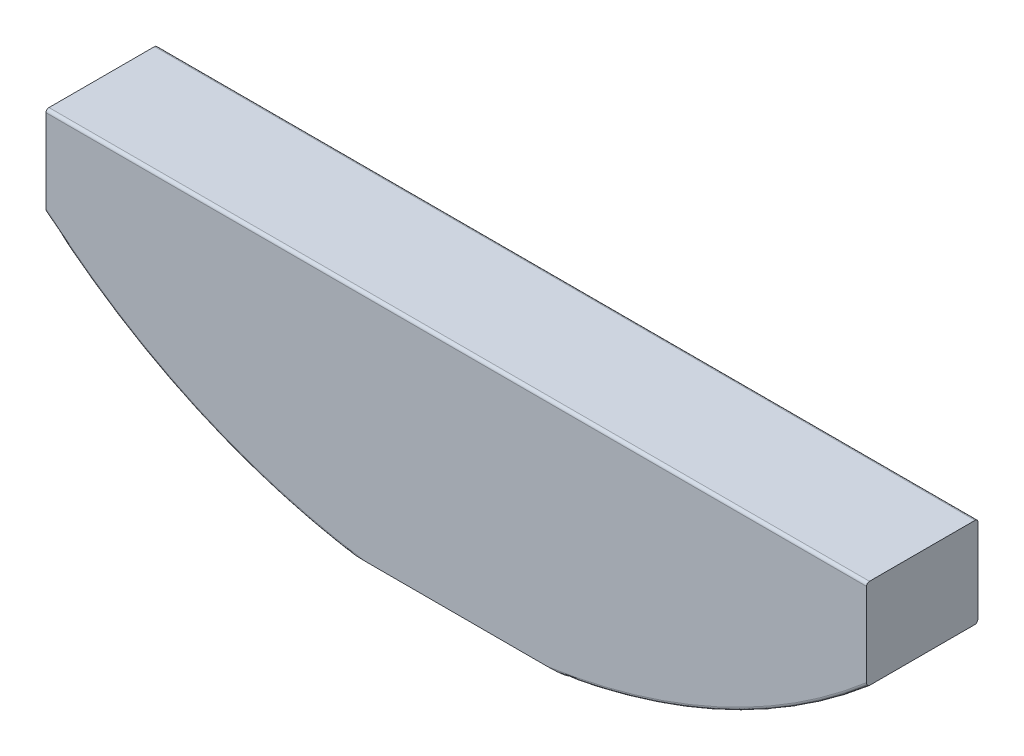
SolidWorks part; units mm, degrees
ref_plane "Front Plane" through (0, 0, 0) normal (0, 0, 1) x (1, 0, 0)
ref_plane "Top Plane" through (0, 0, 0) normal (0, 1, 0) x (1, 0, 0)
ref_plane "Right Plane" through (0, 0, 0) normal (1, 0, 0) x (0, 0, -1)
sketch "Sketch1" plane through (0, 0, 0) normal (0, 0, 1) x (1, 0, 0)
  line L0 (-73.722, 0) -> (74.6512, 0) construction
  line L1 (-21.2245, -16.6687) -> (21.2245, -16.6687)
  arc A0 (-21.2245, -16.6687) -> (21.2245, -16.6687) centre (0, 0) ccw
  dimension "Breadth" = 53.975
  dimension "Excursion" = 16.6687
extrude "Extrude1" add sketch "Sketch1" along normal blind 4.7625
fillet "Fillet3" radius 0.127 6 edges at (-21.2245, -16.6687, 2.3813) (21.2245, -16.6687, 2.3813) (0, -16.6687, 4.7625) (0, -26.9875, 4.7625) (0, -16.6687, 0) (0, -26.9875, 0)
sketch "Sketch3" plane through (0, 0, 0) normal (0, 0, 1) x (1, 0, 0)
  line L0 (-50.8, -26.5748) -> (50.8, -26.5748)
  line L2 (-20.9616, -16.6687) -> (20.9616, -16.6687) construction
  dimension "D1" = 50.8
  dimension "D2" = 101.6
  dimension "High" = 9.906
extrude "Cut-Extrude2" cut sketch "Sketch3" along normal through all and the other way through all flip side to cut
sketch "Sketch2" plane through (0, 0, 0) normal (0, 0, 1) x (1, 0, 0)
  line L0 (-17.526, 0) -> (-17.526, -50.8)
  line L1 (0, 0) -> (0, -50.8) construction
  dimension "D1" = 50.8
  dimension "Length" = 35.052
extrude "Cut-Extrude1" cut sketch "Sketch2" against normal through all and the other way through all flip side to cut
mirror "Mirror1" about plane through (0, 0, 0) normal (1, 0, 0) of "Cut-Extrude1"
equation "\"Radius@Fillet3\" = \"Width@Extrude1\"*2/75"
